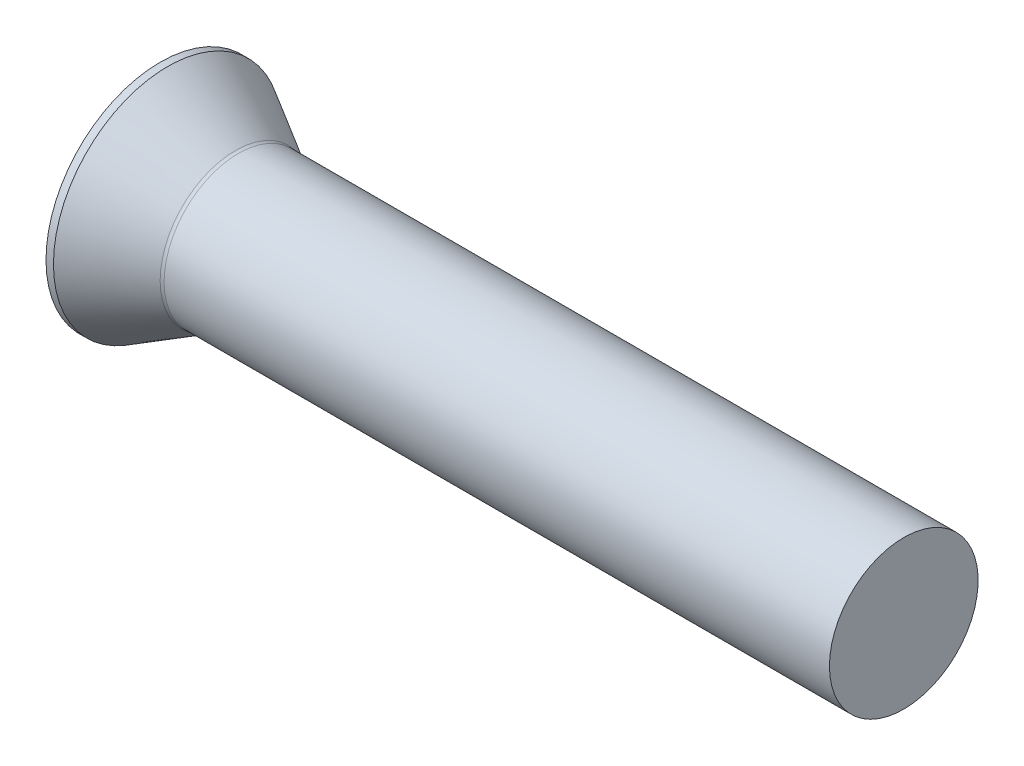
SolidWorks part; units mm, degrees
ref_plane "Front" through (0, 0, 0) normal (0, 0, 1) x (1, 0, 0)
ref_plane "Top" through (0, 0, 0) normal (0, 1, 0) x (1, 0, 0)
ref_plane "Right" through (0, 0, 0) normal (1, 0, 0) x (0, 0, -1)
other "Configuration Table"
sketch "Sketch1" plane through (0, 0, 0) normal (0, 0, 1) x (1, 0, 0)
  line L0 (-34.7299, 0) -> (14.8285, 0) construction
  line L1 (62.625, 0) -> (62.625, 6)
  line L2 (62.625, 6) -> (8.934, 6)
  line L3 (8.684, 6.067) -> (3.225, 9.2187)
  line L4 (3.225, 9.2187) -> (2.625, 9.2187)
  line L5 (62.625, 0) -> (0, 0)
  line L6 (8.684, 6.067) -> (8.8, 6) construction
  line L7 (8.934, 6) -> (8.8, 6) construction
  line L8 (0, 0) -> (0, -9.1875) construction
  arc A0 (2.625, 9.2187) -> (0, 0) centre (17.5, 0) ccw
  arc A1 (8.934, 6) -> (8.684, 6.067) centre (8.934, 6.5) cw
  point P12 (8.8, 6)
  point P13 (8.8, 6)
  dimension "R" = 17.5
  dimension "r1" = 0.5
  dimension "d" = 12
  dimension "l" = 60
  dimension "D2" = 30
  dimension "b" = 0.6
  dimension "k" = 8.8
revolve "Base-Revolve" add sketch "Sketch1" angle 360 about L0
